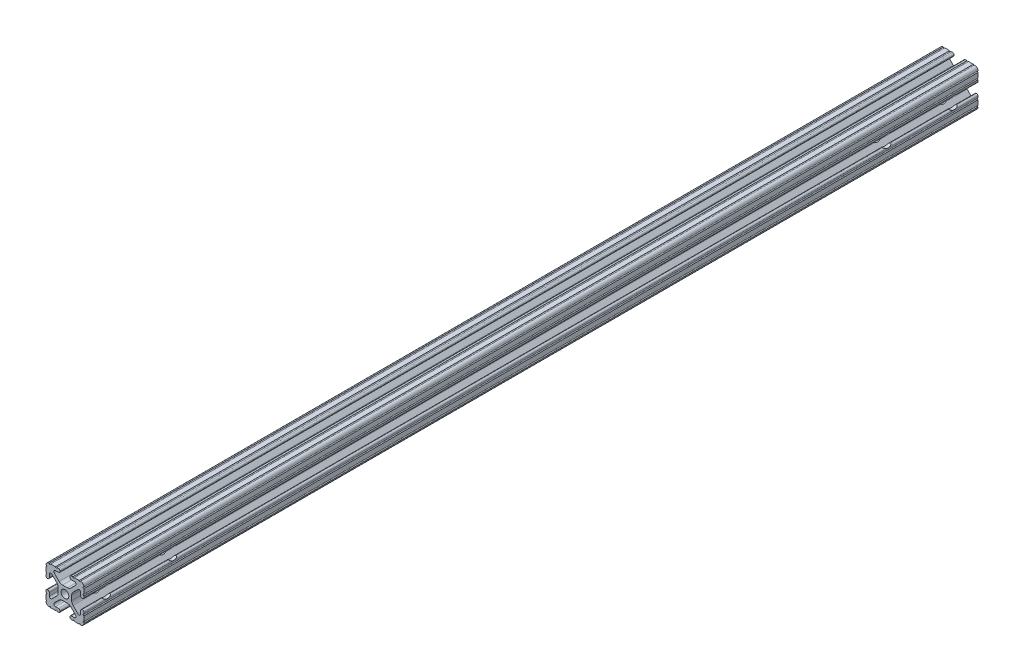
SolidWorks part; units mm, degrees
ref_plane "Front Plane" through (0, 0, 0) normal (0, 0, 1) x (1, 0, 0)
ref_plane "Top Plane" through (0, 0, 0) normal (0, 1, 0) x (1, 0, 0)
ref_plane "Right Plane" through (0, 0, 0) normal (1, 0, 0) x (0, 0, -1)
sketch "Sketch1" plane through (0, 0, 0) normal (0, 0, 1) x (1, 0, 0)
  line L88 (-7.1797, -8.6452) -> (-3.9523, -5.4237)
  line L89 (-1.7093, -4.4958) -> (1.7093, -4.4958)
  line L90 (3.9523, -5.4237) -> (7.1797, -8.6452)
  line L91 (6.4164, -10.4902) -> (4.2875, -10.4902)
  line L92 (3.2385, -11.5392) -> (3.2385, -11.651)
  line L93 (4.2875, -12.7) -> (5.3171, -12.7)
  line L94 (6.3331, -12.7) -> (9.5504, -12.7)
  line L95 (12.7, -9.5504) -> (12.7, -6.3331)
  line L96 (12.7, -5.3171) -> (12.7, -4.2875)
  line L97 (11.651, -3.2385) -> (11.5392, -3.2385)
  line L98 (10.4902, -4.2875) -> (10.4902, -6.4021)
  line L99 (8.7371, -7.1294) -> (5.441, -3.8408)
  line L100 (4.5085, -1.5932) -> (4.5085, 1.5932)
  line L101 (5.441, 3.8408) -> (8.7371, 7.1294)
  line L102 (10.4902, 6.4021) -> (10.4902, 4.2875)
  line L103 (11.5392, 3.2385) -> (11.651, 3.2385)
  line L104 (12.7, 4.2875) -> (12.7, 5.3171)
  line L105 (12.7, 6.3331) -> (12.7, 9.5504)
  line L106 (9.5504, 12.7) -> (6.3331, 12.7)
  line L107 (5.3171, 12.7) -> (4.2875, 12.7)
  line L108 (3.2385, 11.651) -> (3.2385, 11.5392)
  line L109 (4.2875, 10.4902) -> (6.4768, 10.4902)
  line L110 (7.207, 8.7244) -> (3.8983, 5.4232)
  line L111 (1.6558, 4.4958) -> (-1.6558, 4.4958)
  line L112 (-3.8983, 5.4232) -> (-7.207, 8.7244)
  line L113 (-6.4768, 10.4902) -> (-4.2875, 10.4902)
  line L114 (-3.2385, 11.5392) -> (-3.2385, 11.651)
  line L115 (-4.2875, 12.7) -> (-5.3171, 12.7)
  line L116 (-6.3331, 12.7) -> (-9.5504, 12.7)
  line L117 (-12.7, 9.5504) -> (-12.7, 6.3331)
  line L118 (-12.7, 5.3171) -> (-12.7, 4.2875)
  line L119 (-11.651, 3.2385) -> (-11.5392, 3.2385)
  line L120 (-10.4902, 4.2875) -> (-10.4902, 6.4021)
  line L121 (-8.7371, 7.1294) -> (-5.441, 3.8408)
  line L122 (-4.5085, 1.5932) -> (-4.5085, -1.5932)
  line L123 (-5.441, -3.8408) -> (-8.7371, -7.1294)
  line L124 (-10.4902, -6.4021) -> (-10.4902, -4.2875)
  line L125 (-11.5392, -3.2385) -> (-11.651, -3.2385)
  line L126 (-12.7, -4.2875) -> (-12.7, -5.3171)
  line L127 (-12.7, -6.3331) -> (-12.7, -9.5504)
  line L128 (-9.5504, -12.7) -> (-6.3331, -12.7)
  line L129 (-5.3171, -12.7) -> (-4.2875, -12.7)
  line L130 (-3.2385, -11.651) -> (-3.2385, -11.5392)
  line L131 (-4.2875, -10.4902) -> (-6.4164, -10.4902)
  circle A1 centre (0, 0) radius 2.6035
  arc A104 (-7.1797, -8.6452) -> (-6.4164, -10.4902) centre (-6.4164, -9.4098) ccw
  arc A105 (-1.7093, -4.4958) -> (-3.9523, -5.4237) centre (-1.7093, -7.6708) ccw
  arc A106 (3.9523, -5.4237) -> (1.7093, -4.4958) centre (1.7093, -7.6708) ccw
  arc A107 (6.4164, -10.4902) -> (7.1797, -8.6452) centre (6.4164, -9.4098) ccw
  arc A108 (4.2875, -10.4902) -> (3.2385, -11.5392) centre (4.2875, -11.5392) ccw
  arc A109 (3.2385, -11.651) -> (4.2875, -12.7) centre (4.2875, -11.651) ccw
  arc A110 (6.3331, -12.7) -> (5.3171, -12.7) centre (5.8251, -12.7) ccw
  arc A111 (10.5664, -12.6998) -> (9.5504, -12.7) centre (10.0584, -12.7) ccw
  arc A112 (10.5664, -12.6998) -> (12.6998, -10.5664) centre (10.5918, -10.5918) ccw
  arc A113 (12.7, -9.5504) -> (12.6998, -10.5664) centre (12.7, -10.0584) ccw
  arc A114 (12.7, -5.3171) -> (12.7, -6.3331) centre (12.7, -5.8251) ccw
  arc A115 (12.7, -4.2875) -> (11.651, -3.2385) centre (11.651, -4.2875) ccw
  arc A116 (11.5392, -3.2385) -> (10.4902, -4.2875) centre (11.5392, -4.2875) ccw
  arc A117 (8.7371, -7.1294) -> (10.4902, -6.4021) centre (9.4628, -6.4021) ccw
  arc A118 (4.5085, -1.5932) -> (5.441, -3.8408) centre (7.6835, -1.5932) ccw
  arc A119 (5.441, 3.8408) -> (4.5085, 1.5932) centre (7.6835, 1.5932) ccw
  arc A120 (10.4902, 6.4021) -> (8.7371, 7.1294) centre (9.4628, 6.4021) ccw
  arc A121 (10.4902, 4.2875) -> (11.5392, 3.2385) centre (11.5392, 4.2875) ccw
  arc A122 (11.651, 3.2385) -> (12.7, 4.2875) centre (11.651, 4.2875) ccw
  arc A123 (12.7, 6.3331) -> (12.7, 5.3171) centre (12.7, 5.8251) ccw
  arc A124 (12.6998, 10.5664) -> (12.7, 9.5504) centre (12.7, 10.0584) ccw
  arc A125 (12.6998, 10.5664) -> (10.5664, 12.6998) centre (10.5918, 10.5918) ccw
  arc A126 (9.5504, 12.7) -> (10.5664, 12.6998) centre (10.0584, 12.7) ccw
  arc A127 (5.3171, 12.7) -> (6.3331, 12.7) centre (5.8251, 12.7) ccw
  arc A128 (4.2875, 12.7) -> (3.2385, 11.651) centre (4.2875, 11.651) ccw
  arc A129 (3.2385, 11.5392) -> (4.2875, 10.4902) centre (4.2875, 11.5392) ccw
  arc A130 (7.207, 8.7244) -> (6.4768, 10.4902) centre (6.4768, 9.4563) ccw
  arc A131 (1.6558, 4.4958) -> (3.8983, 5.4232) centre (1.6558, 7.6708) ccw
  arc A132 (-3.8983, 5.4232) -> (-1.6558, 4.4958) centre (-1.6558, 7.6708) ccw
  arc A133 (-6.4768, 10.4902) -> (-7.207, 8.7244) centre (-6.4768, 9.4563) ccw
  arc A134 (-4.2875, 10.4902) -> (-3.2385, 11.5392) centre (-4.2875, 11.5392) ccw
  arc A135 (-3.2385, 11.651) -> (-4.2875, 12.7) centre (-4.2875, 11.651) ccw
  arc A136 (-6.3331, 12.7) -> (-5.3171, 12.7) centre (-5.8251, 12.7) ccw
  arc A137 (-10.5664, 12.6998) -> (-9.5504, 12.7) centre (-10.0584, 12.7) ccw
  arc A138 (-10.5664, 12.6998) -> (-12.6998, 10.5664) centre (-10.5918, 10.5918) ccw
  arc A139 (-12.7, 9.5504) -> (-12.6998, 10.5664) centre (-12.7, 10.0584) ccw
  arc A140 (-12.7, 5.3171) -> (-12.7, 6.3331) centre (-12.7, 5.8251) ccw
  arc A141 (-12.7, 4.2875) -> (-11.651, 3.2385) centre (-11.651, 4.2875) ccw
  arc A142 (-11.5392, 3.2385) -> (-10.4902, 4.2875) centre (-11.5392, 4.2875) ccw
  arc A143 (-8.7371, 7.1294) -> (-10.4902, 6.4021) centre (-9.4628, 6.4021) ccw
  arc A144 (-4.5085, 1.5932) -> (-5.441, 3.8408) centre (-7.6835, 1.5932) ccw
  arc A145 (-5.441, -3.8408) -> (-4.5085, -1.5932) centre (-7.6835, -1.5932) ccw
  arc A146 (-10.4902, -6.4021) -> (-8.7371, -7.1294) centre (-9.4628, -6.4021) ccw
  arc A147 (-10.4902, -4.2875) -> (-11.5392, -3.2385) centre (-11.5392, -4.2875) ccw
  arc A148 (-11.651, -3.2385) -> (-12.7, -4.2875) centre (-11.651, -4.2875) ccw
  arc A149 (-12.7, -6.3331) -> (-12.7, -5.3171) centre (-12.7, -5.8251) ccw
  arc A150 (-12.6998, -10.5664) -> (-12.7, -9.5504) centre (-12.7, -10.0584) ccw
  arc A151 (-12.6998, -10.5664) -> (-10.5664, -12.6998) centre (-10.5918, -10.5918) ccw
  arc A152 (-9.5504, -12.7) -> (-10.5664, -12.6998) centre (-10.0584, -12.7) ccw
  arc A153 (-5.3171, -12.7) -> (-6.3331, -12.7) centre (-5.8251, -12.7) ccw
  arc A154 (-4.2875, -12.7) -> (-3.2385, -11.651) centre (-4.2875, -11.651) ccw
  arc A155 (-3.2385, -11.5392) -> (-4.2875, -10.4902) centre (-4.2875, -11.5392) ccw
extrude "Boss-Extrude1" add sketch "Sketch1" along normal mid plane 599.44
sketch "Sketch3" plane through (12.7, 0, 0) normal (1, 0, 0) x (0, 0, -1)
  line L0 (-283.845, -0.0002) -> (-239.395, -0.0002) construction
  line L1 (-299.72, 12.6998) -> (299.72, 12.6998) construction
  line L2 (-299.72, -9.5504) -> (-299.72, -6.3331) construction
  line L3 (239.395, -0.0002) -> (283.845, -0.0002) construction
  line L6 (299.72, -1.5932) -> (299.72, 1.5932) construction
  circle A0 centre (-283.845, -0.0002) radius 4.1656
  circle A1 centre (-239.395, -0.0002) radius 4.1656
  circle A2 centre (283.845, -0.0002) radius 4.1656
  circle A3 centre (239.395, -0.0002) radius 4.1656
  point P14 (299.72, 0)
  dimension "D1" = 8.3312
  dimension "D2" = 8.3312
  dimension "D4" = 12.7
  dimension "D5" = 15.875
  dimension "D7" = 8.3312
  dimension "D8" = 8.3312
  dimension "D9" = 15.875
  dimension "D10" = 12.7
  dimension "D3" = 44.45
  dimension "D6" = 44.45
extrude "Cut-Extrude1" cut sketch "Sketch3" against normal through all
sketch "Sketch4" plane through (0, 12.7, 0) normal (0, 1, 0) x (1, 0, 0)
  line L0 (12.6998, -299.72) -> (12.6998, 299.72) construction
  line L1 (-6.3331, 299.72) -> (-9.5504, 299.72) construction
  line L2 (-6.3331, -299.72) -> (-9.5504, -299.72) construction
  circle A0 centre (-0.0002, 236.22) radius 3.175
  circle A1 centre (-0.0002, -223.52) radius 3.175
  dimension "D1" = 6.35
  dimension "D2" = 12.7
  dimension "D3" = 63.5
  dimension "D4" = 6.35
  dimension "D5" = 12.7
  dimension "D6" = 76.2
extrude "Cut-Extrude2" cut sketch "Sketch4" against normal through all
